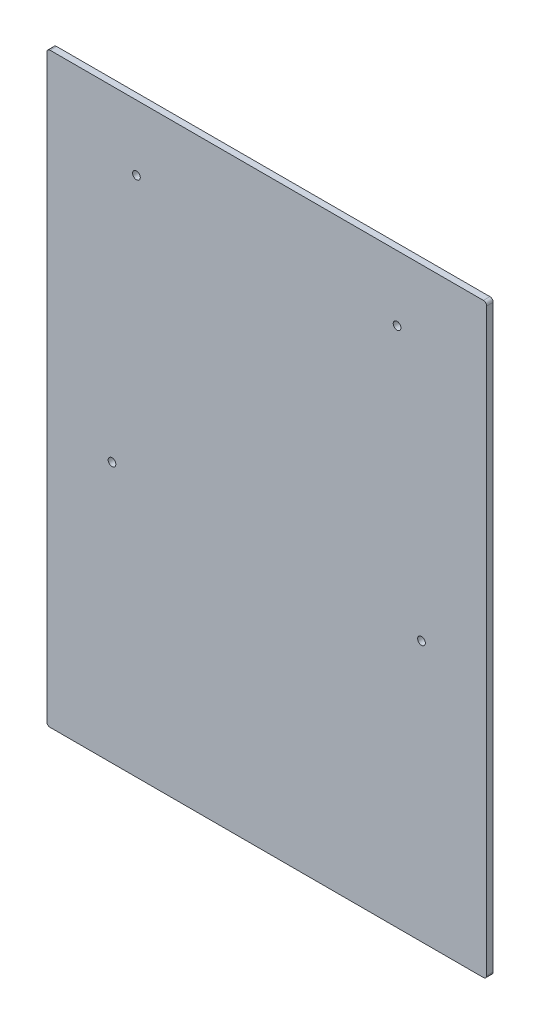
SolidWorks part; units mm, degrees
ref_plane "Front Plane" through (0, 0, 0) normal (0, 0, 1) x (1, 0, 0)
ref_plane "Top Plane" through (0, 0, 0) normal (0, 1, 0) x (1, 0, 0)
ref_plane "Right Plane" through (0, 0, 0) normal (1, 0, 0) x (0, 0, -1)
sketch "Sketch1" plane through (0, 0, 0) normal (0, 0, 1) x (1, 0, 0)
  line L1 (-171.45, 228.6) -> (171.45, 228.6)
  line L2 (-171.45, 228.6) -> (-171.45, -228.6)
  line L3 (-171.45, -228.6) -> (171.45, -228.6)
  line L4 (171.45, 228.6) -> (171.45, -228.6)
  line L5 (-171.45, 228.6) -> (171.45, -228.6) construction
  line L6 (-171.45, -228.6) -> (171.45, 228.6) construction
  point P0 (0, 0)
  dimension "D1" = 342.9
  dimension "D2" = 457.2
extrude "Boss-Extrude1" add sketch "Sketch1" along normal blind 5.08
fillet "Fillet1" radius 2.54 4 edges at (-171.45, -228.6, 2.54) (171.45, -228.6, 2.54) (-171.45, 228.6, 2.54) (171.45, 228.6, 2.54)
sketch "Sketch2" plane through (0, 0, 5.08) normal (0, 0, 1) x (1, 0, 0)
  line L0 (0, 0) -> (0, 50000) construction
  line L1 (-259.102, 177.8) -> (287.4127, 177.8) construction
  line L2 (168.91, 228.6) -> (-168.91, 228.6) construction
  line L3 (-259.102, -25.4) -> (287.4127, -25.4) construction
  circle A0 centre (-101.6, 177.8) radius 3
  circle A3 centre (-120.65, -25.4) radius 3
  dimension "D2" = 203.2
  dimension "D3" = 6
  dimension "D4" = 203.2
  dimension "D5" = 6
  dimension "D6" = 241.3
  dimension "D1" = 50.8
extrude "Cut-Extrude1" cut sketch "Sketch2" against normal through all
mirror "Mirror1" about plane through (0, 0, 0) normal (1, 0, 0) of "Cut-Extrude1"
